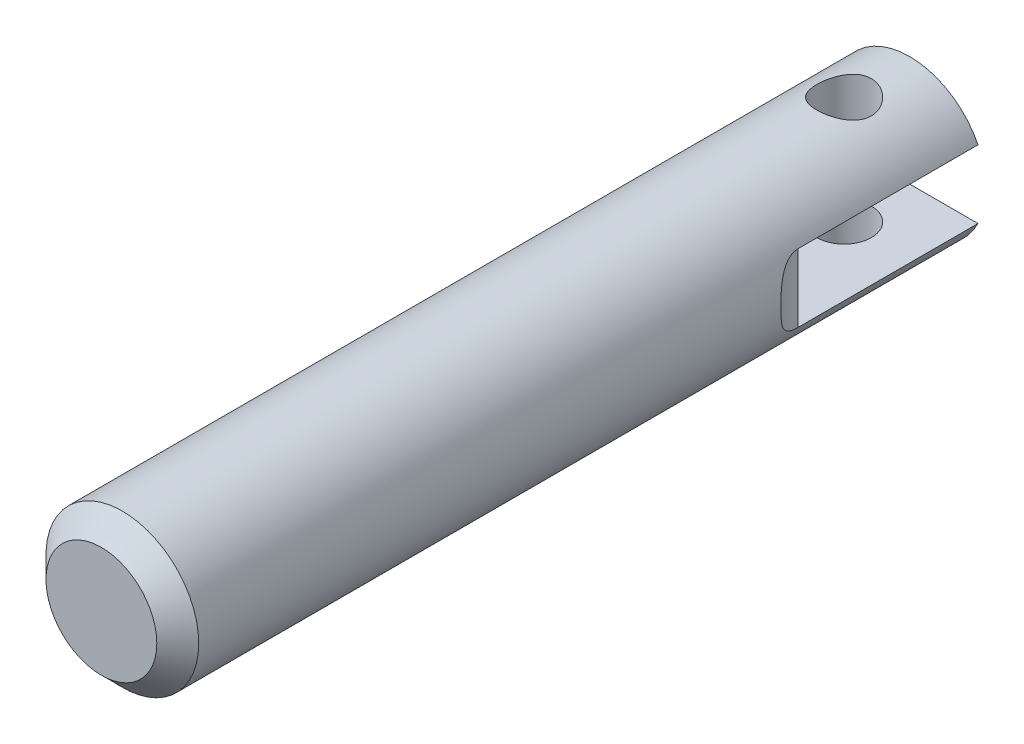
SolidWorks part; units mm, degrees
ref_plane "Front Plane" through (0, 0, 0) normal (0, 0, 1) x (1, 0, 0)
ref_plane "Top Plane" through (0, 0, 0) normal (0, 1, 0) x (1, 0, 0)
ref_plane "Right Plane" through (0, 0, 0) normal (1, 0, 0) x (0, 0, -1)
sketch "Sketch1" plane through (0, 0, 0) normal (0, 0, 1) x (1, 0, 0)
  circle A0 centre (0, 0) radius 5.5499
  dimension "D1" = 11.0998
extrude "Boss-Extrude1" add sketch "Sketch1" against normal blind 58.7375
chamfer "Chamfer1" distance 1.524 angle 45 1 edges at (5.5499, 0, 0)
sketch "Sketch2" plane through (0, 0, 0) normal (0, 1, 0) x (1, 0, 0)
  line L0 (5.5499, 58.7375) -> (-5.5499, 58.7375) construction
  line L1 (-6.35, 45.6565) -> (6.35, 45.6565)
  line L2 (-6.35, 45.6565) -> (-6.35, 58.7375)
  line L3 (-6.35, 58.7375) -> (6.35, 58.7375)
  line L4 (6.35, 45.6565) -> (6.35, 58.7375)
  point P6 (0, 58.7375)
  dimension "D1" = 13.081
  dimension "D2" = 12.7
extrude "Cut-Extrude1" cut sketch "Sketch2" against normal mid plane 4.953
sketch "Sketch3" plane through (0, 0, 0) normal (0, 1, 0) x (1, 0, 0)
  line L0 (5.5499, 45.6565) -> (13.2471, 45.6565) construction
  line L1 (4.9667, 45.6565) -> (4.9667, 58.7375) construction
  circle A0 centre (8.1417, 45.6565) radius 3.175
  dimension "D1" = 6.35
extrude "Cut-Extrude2" cut sketch "Sketch3" against normal through all and the other way through all
mirror "Mirror1" about plane through (0, 0, 0) normal (1, 0, 0) of "Cut-Extrude2"
sketch "Sketch4" plane through (0, 0, 0) normal (0, 1, 0) x (1, 0, 0)
  line L0 (0, 0) -> (0, 83.7784) construction
  line L1 (4.9667, 58.7375) -> (-4.9667, 58.7375) construction
  circle A0 centre (0, 53.975) radius 1.9812
  dimension "D1" = 4.7625
  dimension "D2" = 3.9624
extrude "Cut-Extrude3" cut sketch "Sketch4" against normal mid plane 50.8
